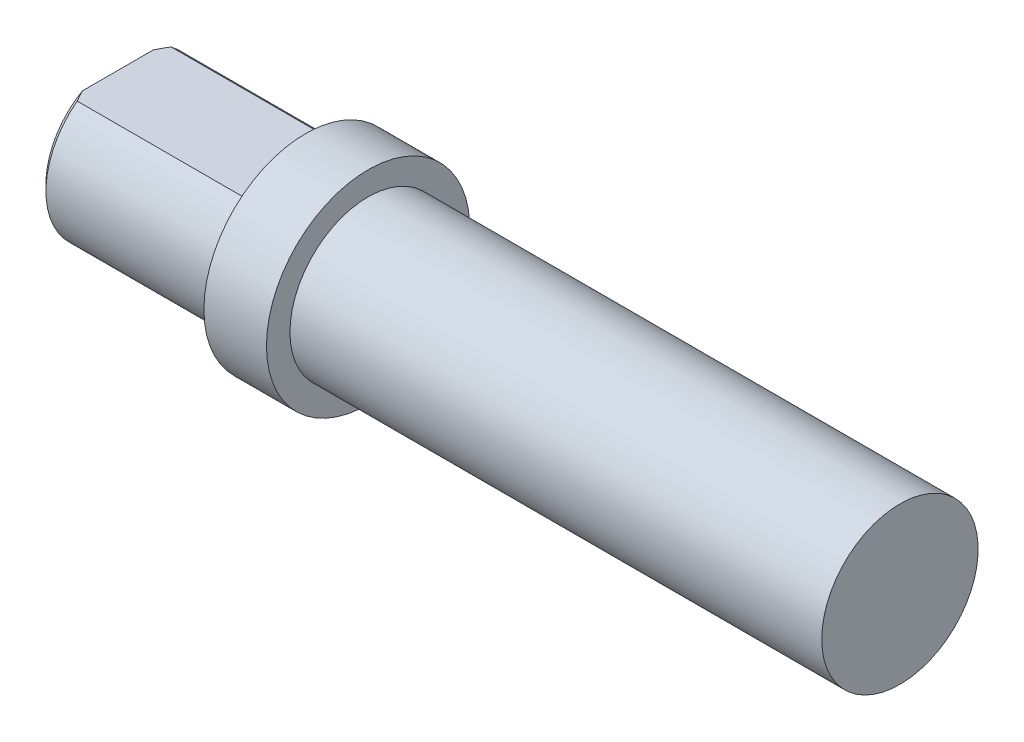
SolidWorks part; units mm, degrees
ref_plane "Plan de face" through (0, 0, 0) normal (0, 0, 1) x (1, 0, 0)
ref_plane "Plan de dessus" through (0, 0, 0) normal (0, 1, 0) x (1, 0, 0)
ref_plane "Plan de droite" through (0, 0, 0) normal (1, 0, 0) x (0, 0, -1)
sketch "Esquisse1" plane through (0, 0, 0) normal (0, 0, 1) x (1, 0, 0)
  line L0 (0, 0) -> (29.185, 0) construction
  line L1 (0, 0) -> (0, 2.5)
  line L4 (0, 2.5) -> (-25, 2.5)
  line L5 (-25, 2.5) -> (-25, 0)
  line L6 (-25, 0) -> (0, 0)
  dimension "D1" = 5
  dimension "D2" = 25
revolve "Révolution1" add sketch "Esquisse1" angle 360 about L0
sketch "Esquisse2" plane through (-25, 0, 0) normal (-1, 0, 0) x (0, 0, 1)
  line L0 (-1.5, 2) -> (0, 2)
  line L1 (0, 2) -> (0, 0) construction
  line L2 (0, 2) -> (1.5, 2)
  line L3 (0, 0) -> (0, -2.5) construction
  circle A0 centre (0, 0) radius 2.5 construction
  arc A1 (1.5, 2) -> (-1.5, 2) centre (0, 0) ccw
  dimension "D1" = 4.5
extrude "Enlèv. mat.-Extru.1" cut sketch "Esquisse2" against normal blind 8
chamfer "Chanfrein1" distance 0.2 angle 45 1 edges at (-25, -2.5, 0)
sketch "Esquisse3" plane through (-17, 0, 0) normal (-1, 0, 0) x (0, 0, 1)
  circle A0 centre (0, 0) radius 3.25
  dimension "D1" = 6.5
extrude "Boss.-Extru.1" add sketch "Esquisse3" along normal blind 2
